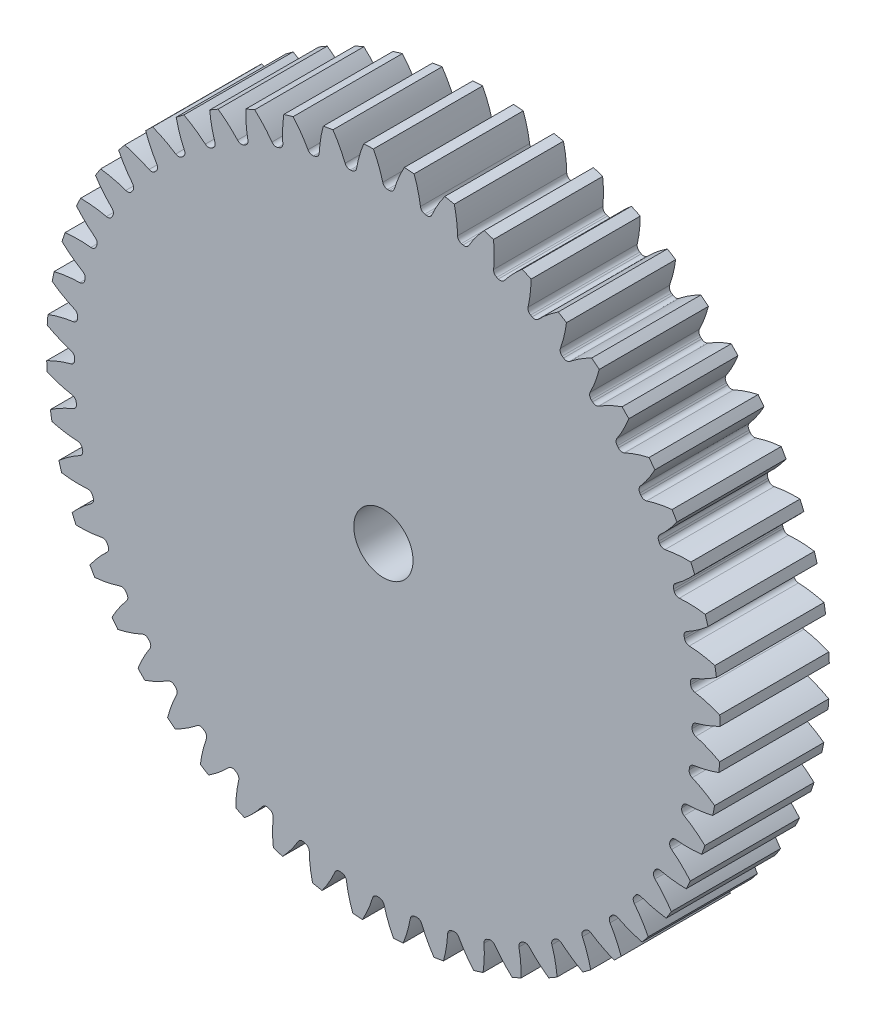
SolidWorks part; units mm, degrees
ref_plane "Front" through (0, 0, 0) normal (0, 0, 1) x (1, 0, 0)
ref_plane "Top" through (0, 0, 0) normal (0, 1, 0) x (1, 0, 0)
ref_plane "Right" through (0, 0, 0) normal (1, 0, 0) x (0, 0, -1)
sketch "Sketch3" plane through (0, 0, 0) normal (0, 0, 1) x (1, 0, 0)
  circle A0 centre (0, 0) radius 274.32
  dimension "od" = 548.64
extrude "gearBody" add sketch "Sketch3" along normal blind 88.9
sketch "Sketch2" plane through (0, 0, 0) normal (0, 0, 1) x (1, 0, 0)
  line L0 (0, 0) -> (229.3339, 94.9932) construction
  line L1 (273.9061, -17.1492) -> (0, 0) construction
  line L2 (0, 0) -> (36.3143, 0) construction
  line L3 (264.135, 3.6361) -> (263.8755, -12.2577) construction
  line L5 (264.0052, -4.3108) -> (0, 0) construction
  line L7 (0, 0) -> (248.2292, 0) construction
  arc A0 (248.2275, -0.9249) -> (248.1253, -7.1798) centre (0, 0) ccw construction
  arc A1 (274.1993, 8.1351) -> (273.7876, -17.0829) centre (0, 0) ccw construction
  arc A2 (264.135, 3.6361) -> (263.8755, -12.2577) centre (0, 0) ccw construction
  arc A3 (251.4142, -4.7998) -> (251.4369, -3.411) centre (0, 0) ccw
  arc A4 (273.9061, -17.1492) -> (254.3539, -8.8375) centre (226.1103, -102.4299) ccw
  arc A5 (273.9061, -17.1492) -> (274.32, 8.1975) centre (0, 0) ccw
  arc A6 (274.32, 8.1975) -> (254.5068, 0.5286) centre (229.3339, 94.9932) cw
  arc A7 (251.4369, -3.411) -> (254.5068, 0.5286) centre (255.5716, -3.4671) cw
  arc A8 (254.3539, -8.8375) -> (251.4142, -4.7998) centre (255.5486, -4.8787) cw
  point P6 (274.32, 8.1975)
  point P22 (273.9061, -17.1492)
  dimension "baseDia" = 496.4584
  dimension "od" = 548.64
  dimension "pd" = 528.32
  dimension "rd" = 502.92
  dimension "rFillet" = 4.1351
  dimension "pointX" = 274.32
  dimension "pointY" = 8.1975
  dimension "CTT" = 15.8937
  dimension "flankCenterAngle" = 22.5
extrude "toothCut" cut sketch "Sketch2" along normal through all
pattern_circular "CirPattern1" count 52 over 360 about axis through (0, 0, 0) along (0, 0, 1) of "toothCut"
sketch "hub1Dia" plane through (0, 0, 0) normal (0, 0, -1) x (-1, 0, 0)
  circle A0 centre (0, 0) radius 12.7
  dimension "hub1Dia" = 25.4
sketch "hub2Dia" plane through (0, 0, 88.9) normal (0, 0, 1) x (1, 0, 0)
  circle A0 centre (0, 0) radius 12.7
  dimension "hub2dia" = 25.4
sketch "boreDia" plane through (0, 0, 0) normal (0, 0, 1) x (1, 0, 0)
  circle A0 centre (0, 0) radius 24.13
  dimension "boreDia" = 48.26
extrude "bore" cut sketch "boreDia" against normal mid plane 25400
